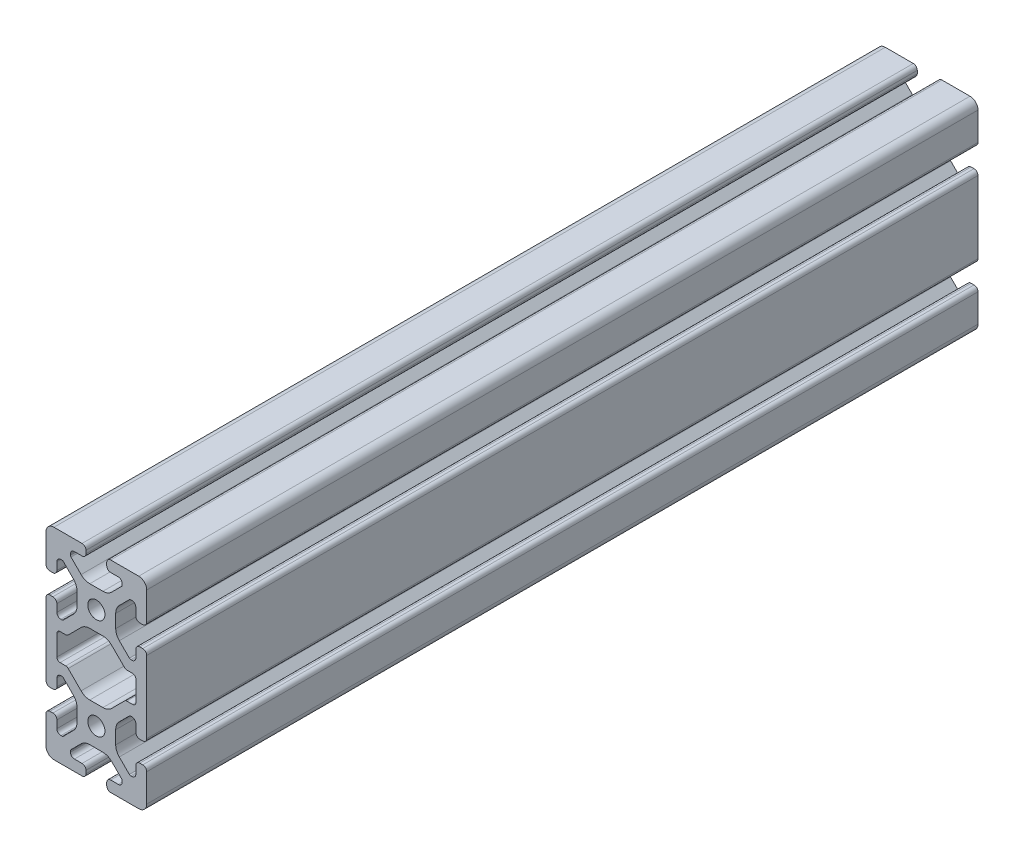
SolidWorks part; units mm, degrees
ref_plane "Front Plane" through (0, 0, 0) normal (0, 0, 1) x (1, 0, 0)
ref_plane "Top Plane" through (0, 0, 0) normal (0, 1, 0) x (1, 0, 0)
ref_plane "Right Plane" through (0, 0, 0) normal (1, 0, 0) x (0, 0, -1)
ref_plane "Plane1" through (0, 0, -3048) normal (0, 0, -1) x (-1, 0, 0)
sketch "Sketch1" plane through (0, 0, -3048) normal (0, 0, -1) x (-1, 0, 0)
  line L0 (14.41, 14.6586) -> (12.13, 14.6586)
  line L1 (11.1794, 14.2308) -> (6.0551, 9.1098)
  line L2 (2.6153, 7.685) -> (-2.6153, 7.685)
  line L3 (-6.0551, 9.1098) -> (-11.232, 14.2867)
  line L4 (-12.13, 14.6586) -> (-14.41, 14.6586)
  line L5 (-15.68, 15.9286) -> (-15.68, 24.0714)
  line L6 (-14.41, 25.3414) -> (-12.13, 25.3414)
  line L7 (-11.232, 25.7133) -> (-6.0551, 30.8902)
  line L8 (-2.6153, 32.315) -> (2.6176, 32.315)
  line L9 (6.0573, 30.8902) -> (11.1842, 25.7634)
  line L10 (12.13, 25.3414) -> (14.41, 25.3414)
  line L11 (15.68, 24.0714) -> (15.68, 15.9286)
  line L12 (16.83, 60) -> (5.6904, 60)
  line L13 (4.1204, 58.43) -> (4.1204, 57.25)
  line L14 (5.6904, 55.68) -> (8.7154, 55.68)
  line L15 (10.2854, 54.11) -> (10.2854, 53.6549)
  line L16 (10.0628, 53.1175) -> (6.0551, 49.1098)
  line L17 (2.6153, 47.685) -> (-2.6153, 47.685)
  line L18 (-6.0551, 49.1098) -> (-10.0628, 53.1175)
  line L19 (-10.2854, 53.6549) -> (-10.2854, 54.11)
  line L20 (-8.7154, 55.68) -> (-5.6904, 55.68)
  line L21 (-4.1204, 57.25) -> (-4.1204, 58.43)
  line L22 (-5.6904, 60) -> (-16.83, 60)
  line L23 (-20, 56.83) -> (-20, 45.6904)
  line L24 (-18.43, 44.1204) -> (-17.25, 44.1204)
  line L25 (-15.68, 45.6904) -> (-15.68, 48.7154)
  line L26 (-14.11, 50.2854) -> (-13.6527, 50.2854)
  line L27 (-13.1153, 50.0628) -> (-9.1098, 46.0573)
  line L28 (-7.685, 42.6176) -> (-7.685, 37.3847)
  line L29 (-9.1098, 33.9449) -> (-13.1175, 29.9372)
  line L30 (-13.6549, 29.7146) -> (-14.11, 29.7146)
  line L31 (-15.68, 31.2846) -> (-15.68, 34.3096)
  line L32 (-17.25, 35.8796) -> (-18.43, 35.8796)
  line L33 (-20, 34.3096) -> (-20, 5.6904)
  line L34 (-18.43, 4.1204) -> (-17.25, 4.1204)
  line L35 (-15.68, 5.6904) -> (-15.68, 8.7154)
  line L36 (-14.11, 10.2854) -> (-13.6549, 10.2854)
  line L37 (-13.1175, 10.0628) -> (-9.1098, 6.0551)
  line L38 (-7.685, 2.6153) -> (-7.685, -2.6153)
  line L39 (-9.1098, -6.0551) -> (-13.1175, -10.0628)
  line L40 (-13.6549, -10.2854) -> (-14.11, -10.2854)
  line L41 (-15.68, -8.7154) -> (-15.68, -5.6904)
  line L42 (-17.25, -4.1204) -> (-18.43, -4.1204)
  line L43 (-20, -5.6904) -> (-20, -16.83)
  line L44 (-16.83, -20) -> (-5.6904, -20)
  line L45 (-4.1204, -18.43) -> (-4.1204, -17.25)
  line L46 (-5.6904, -15.68) -> (-8.7154, -15.68)
  line L47 (-10.2854, -14.11) -> (-10.2854, -13.6549)
  line L48 (-10.0628, -13.1175) -> (-6.0551, -9.1098)
  line L49 (-2.6153, -7.685) -> (2.6153, -7.685)
  line L50 (6.0551, -9.1098) -> (10.0628, -13.1175)
  line L51 (10.2854, -13.6549) -> (10.2854, -14.11)
  line L52 (8.7154, -15.68) -> (5.6904, -15.68)
  line L53 (4.1204, -17.25) -> (4.1204, -18.43)
  line L54 (5.6904, -20) -> (16.83, -20)
  line L55 (20, -16.83) -> (20, -5.6904)
  line L56 (18.43, -4.1204) -> (17.25, -4.1204)
  line L57 (15.68, -5.6904) -> (15.68, -8.7154)
  line L58 (14.11, -10.2854) -> (13.6549, -10.2854)
  line L59 (13.1175, -10.0628) -> (9.1098, -6.0551)
  line L60 (7.685, -2.6153) -> (7.685, 2.6153)
  line L61 (9.1098, 6.0551) -> (13.1175, 10.0628)
  line L62 (13.6549, 10.2854) -> (14.11, 10.2854)
  line L63 (15.68, 8.7154) -> (15.68, 5.6904)
  line L64 (17.25, 4.1204) -> (18.43, 4.1204)
  line L65 (20, 5.6904) -> (20, 34.3096)
  line L66 (18.43, 35.8796) -> (17.25, 35.8796)
  line L67 (15.68, 34.3096) -> (15.68, 31.2846)
  line L68 (14.11, 29.7146) -> (13.6549, 29.7146)
  line L69 (13.1175, 29.9372) -> (9.1098, 33.9449)
  line L70 (7.685, 37.3847) -> (7.685, 42.6153)
  line L71 (9.1098, 46.0551) -> (13.1175, 50.0628)
  line L72 (13.6549, 50.2854) -> (14.11, 50.2854)
  line L73 (15.68, 48.7154) -> (15.68, 45.6904)
  line L74 (17.25, 44.1204) -> (18.43, 44.1204)
  line L75 (20, 45.6904) -> (20, 56.83)
  arc A0 (15.68, 15.9286) -> (14.41, 14.6586) centre (14.41, 15.9286) cw
  arc A1 (12.13, 14.6586) -> (11.1794, 14.2308) centre (12.13, 13.3886) ccw
  arc A2 (6.0551, 9.1098) -> (2.6153, 7.685) centre (2.6153, 12.5496) cw
  arc A3 (-2.6153, 7.685) -> (-6.0551, 9.1098) centre (-2.6153, 12.5496) cw
  arc A4 (-11.232, 14.2867) -> (-12.13, 14.6586) centre (-12.13, 13.3886) ccw
  arc A5 (-14.41, 14.6586) -> (-15.68, 15.9286) centre (-14.41, 15.9286) cw
  arc A6 (-15.68, 24.0714) -> (-14.41, 25.3414) centre (-14.41, 24.0714) cw
  arc A7 (-12.13, 25.3414) -> (-11.232, 25.7133) centre (-12.13, 26.6114) ccw
  arc A8 (-6.0551, 30.8902) -> (-2.6153, 32.315) centre (-2.6153, 27.4504) cw
  arc A9 (2.6176, 32.315) -> (6.0573, 30.8902) centre (2.6176, 27.4504) cw
  arc A10 (11.1842, 25.7634) -> (12.13, 25.3414) centre (12.13, 26.6123) ccw
  arc A11 (14.41, 25.3414) -> (15.68, 24.0714) centre (14.41, 24.0714) cw
  circle A12 centre (0, 0) radius 3.405
  circle A13 centre (0, 40) radius 3.405
  arc A14 (5.6904, 60) -> (4.1204, 58.43) centre (5.6904, 58.43) ccw
  arc A15 (4.1204, 57.25) -> (5.6904, 55.68) centre (5.6904, 57.25) ccw
  arc A16 (8.7154, 55.68) -> (10.2854, 54.11) centre (8.7154, 54.11) cw
  arc A17 (10.2854, 53.6549) -> (10.0628, 53.1175) centre (9.5254, 53.6549) cw
  arc A18 (6.0551, 49.1098) -> (2.6153, 47.685) centre (2.6153, 52.5496) cw
  arc A19 (-2.6153, 47.685) -> (-6.0551, 49.1098) centre (-2.6153, 52.5496) cw
  arc A20 (-10.0628, 53.1175) -> (-10.2854, 53.6549) centre (-9.5254, 53.6549) cw
  arc A21 (-10.2854, 54.11) -> (-8.7154, 55.68) centre (-8.7154, 54.11) cw
  arc A22 (-5.6904, 55.68) -> (-4.1204, 57.25) centre (-5.6904, 57.25) ccw
  arc A23 (-4.1204, 58.43) -> (-5.6904, 60) centre (-5.6904, 58.43) ccw
  arc A24 (-16.83, 60) -> (-20, 56.83) centre (-16.83, 56.83) ccw
  arc A25 (-20, 45.6904) -> (-18.43, 44.1204) centre (-18.43, 45.6904) ccw
  arc A26 (-17.25, 44.1204) -> (-15.68, 45.6904) centre (-17.25, 45.6904) ccw
  arc A27 (-15.68, 48.7154) -> (-14.11, 50.2854) centre (-14.11, 48.7154) cw
  arc A28 (-13.6527, 50.2854) -> (-13.1153, 50.0628) centre (-13.6527, 49.5254) cw
  arc A29 (-9.1098, 46.0573) -> (-7.685, 42.6176) centre (-12.5496, 42.6176) cw
  arc A30 (-7.685, 37.3847) -> (-9.1098, 33.9449) centre (-12.5496, 37.3847) cw
  arc A31 (-13.1175, 29.9372) -> (-13.6549, 29.7146) centre (-13.6549, 30.4746) cw
  arc A32 (-14.11, 29.7146) -> (-15.68, 31.2846) centre (-14.11, 31.2846) cw
  arc A33 (-15.68, 34.3096) -> (-17.25, 35.8796) centre (-17.25, 34.3096) ccw
  arc A34 (-18.43, 35.8796) -> (-20, 34.3096) centre (-18.43, 34.3096) ccw
  arc A35 (-20, 5.6904) -> (-18.43, 4.1204) centre (-18.43, 5.6904) ccw
  arc A36 (-17.25, 4.1204) -> (-15.68, 5.6904) centre (-17.25, 5.6904) ccw
  arc A37 (-15.68, 8.7154) -> (-14.11, 10.2854) centre (-14.11, 8.7154) cw
  arc A38 (-13.6549, 10.2854) -> (-13.1175, 10.0628) centre (-13.6549, 9.5254) cw
  arc A39 (-9.1098, 6.0551) -> (-7.685, 2.6153) centre (-12.5496, 2.6153) cw
  arc A40 (-7.685, -2.6153) -> (-9.1098, -6.0551) centre (-12.5496, -2.6153) cw
  arc A41 (-13.1175, -10.0628) -> (-13.6549, -10.2854) centre (-13.6549, -9.5254) cw
  arc A42 (-14.11, -10.2854) -> (-15.68, -8.7154) centre (-14.11, -8.7154) cw
  arc A43 (-15.68, -5.6904) -> (-17.25, -4.1204) centre (-17.25, -5.6904) ccw
  arc A44 (-18.43, -4.1204) -> (-20, -5.6904) centre (-18.43, -5.6904) ccw
  arc A45 (-20, -16.83) -> (-16.83, -20) centre (-16.83, -16.83) ccw
  arc A46 (-5.6904, -20) -> (-4.1204, -18.43) centre (-5.6904, -18.43) ccw
  arc A47 (-4.1204, -17.25) -> (-5.6904, -15.68) centre (-5.6904, -17.25) ccw
  arc A48 (-8.7154, -15.68) -> (-10.2854, -14.11) centre (-8.7154, -14.11) cw
  arc A49 (-10.2854, -13.6549) -> (-10.0628, -13.1175) centre (-9.5254, -13.6549) cw
  arc A50 (-6.0551, -9.1098) -> (-2.6153, -7.685) centre (-2.6153, -12.5496) cw
  arc A51 (2.6153, -7.685) -> (6.0551, -9.1098) centre (2.6153, -12.5496) cw
  arc A52 (10.0628, -13.1175) -> (10.2854, -13.6549) centre (9.5254, -13.6549) cw
  arc A53 (10.2854, -14.11) -> (8.7154, -15.68) centre (8.7154, -14.11) cw
  arc A54 (5.6904, -15.68) -> (4.1204, -17.25) centre (5.6904, -17.25) ccw
  arc A55 (4.1204, -18.43) -> (5.6904, -20) centre (5.6904, -18.43) ccw
  arc A56 (16.83, -20) -> (20, -16.83) centre (16.83, -16.83) ccw
  arc A57 (20, -5.6904) -> (18.43, -4.1204) centre (18.43, -5.6904) ccw
  arc A58 (17.25, -4.1204) -> (15.68, -5.6904) centre (17.25, -5.6904) ccw
  arc A59 (15.68, -8.7154) -> (14.11, -10.2854) centre (14.11, -8.7154) cw
  arc A60 (13.6549, -10.2854) -> (13.1175, -10.0628) centre (13.6549, -9.5254) cw
  arc A61 (9.1098, -6.0551) -> (7.685, -2.6153) centre (12.5496, -2.6153) cw
  arc A62 (7.685, 2.6153) -> (9.1098, 6.0551) centre (12.5496, 2.6153) cw
  arc A63 (13.1175, 10.0628) -> (13.6549, 10.2854) centre (13.6549, 9.5254) cw
  arc A64 (14.11, 10.2854) -> (15.68, 8.7154) centre (14.11, 8.7154) cw
  arc A65 (15.68, 5.6904) -> (17.25, 4.1204) centre (17.25, 5.6904) ccw
  arc A66 (18.43, 4.1204) -> (20, 5.6904) centre (18.43, 5.6904) ccw
  arc A67 (20, 34.3096) -> (18.43, 35.8796) centre (18.43, 34.3096) ccw
  arc A68 (17.25, 35.8796) -> (15.68, 34.3096) centre (17.25, 34.3096) ccw
  arc A69 (15.68, 31.2846) -> (14.11, 29.7146) centre (14.11, 31.2846) cw
  arc A70 (13.6549, 29.7146) -> (13.1175, 29.9372) centre (13.6549, 30.4746) cw
  arc A71 (9.1098, 33.9449) -> (7.685, 37.3847) centre (12.5496, 37.3847) cw
  arc A72 (7.685, 42.6153) -> (9.1098, 46.0551) centre (12.5496, 42.6153) cw
  arc A73 (13.1175, 50.0628) -> (13.6549, 50.2854) centre (13.6549, 49.5254) cw
  arc A74 (14.11, 50.2854) -> (15.68, 48.7154) centre (14.11, 48.7154) cw
  arc A75 (15.68, 45.6904) -> (17.25, 44.1204) centre (17.25, 45.6904) ccw
  arc A76 (18.43, 44.1204) -> (20, 45.6904) centre (18.43, 45.6904) ccw
  arc A77 (20, 56.83) -> (16.83, 60) centre (16.83, 56.83) ccw
extrude "Boss-Extrude1" add sketch "Sketch1" against normal blind 3048
ref_plane "2.5 ft cut1" through (0, 0, -762) normal (0, 0, 1) x (1, 0, 0)
ref_plane "2.5 ft cut2" through (0, 0, -1524) normal (0, 0, 1) x (1, 0, 0)
ref_plane "16.14 in cut3" through (0, 0, -1933.956) normal (0, 0, 1) x (1, 0, 0)
ref_plane "13 in cut4" through (0, 0, -2264.156) normal (0, 0, 1) x (1, 0, 0)
ref_plane "midplane cut5" through (0, 0, -2656.078) normal (0, 0, 1) x (1, 0, 0)
sketch "Sketch26" plane through (0, 0, -762) normal (0, 0, 1) x (1, 0, 0)
  line L0 (-20, -20.8001) -> (20, -20.8001)
  line L1 (-20, -20.8001) -> (-20, 60)
  line L2 (-20, 60) -> (20, 60)
  line L3 (20, -20.8001) -> (20, 60)
sketch "Sketch33" plane through (0, 0, -1524) normal (0, 0, 1) x (1, 0, 0)
  line L5 (-20, 60) -> (20, 60)
  line L6 (-20, 60) -> (-20, -20.8001)
  line L7 (-20, -20.8001) -> (20, -20.8001)
  line L8 (20, 60) -> (20, -20.8001)
sketch "Sketch41" plane through (0, 0, -1933.956) normal (0, 0, 1) x (1, 0, 0)
  line L0 (-20, -20.8001) -> (20, -20.8001)
  line L1 (-20, -20.8001) -> (-20, 60)
  line L2 (-20, 60) -> (20, 60)
  line L3 (20, -20.8001) -> (20, 60)
sketch "Sketch50" plane through (0, 0, -2264.156) normal (0, 0, 1) x (1, 0, 0)
  line L0 (-20, -20.8001) -> (20, -20.8001)
  line L1 (-20, -20.8001) -> (-20, 60)
  line L2 (-20, 60) -> (20, 60)
  line L3 (20, -20.8001) -> (20, 60)
sketch "Sketch51" plane through (0, 0, -2656.078) normal (0, 0, 1) x (1, 0, 0)
  line L1 (-20, 60) -> (20, 60)
  line L2 (-20, 60) -> (-20, -20.8001)
  line L3 (-20, -20.8001) -> (20, -20.8001)
  line L4 (20, 60) -> (20, -20.8001)
extrude "Cut-Extrude1" cut sketch "Sketch26" along normal through all
extrude "Cut-Extrude2" cut sketch "Sketch33" along normal through all
extrude "Cut-Extrude3" cut sketch "Sketch41" along normal through all
extrude "Cut-Extrude4" cut sketch "Sketch50" against normal through all
sketch "Sketch52" plane through (-20, 0, 0) normal (-1, 0, 0) x (0, 0, 1)
  circle A0 centre (-1972.456, 38.65) radius 2.5
  circle A1 centre (-2009.756, 38.65) radius 2.5
  circle A2 centre (-2009.756, 1.35) radius 2.5
  circle A3 centre (-1972.456, 1.35) radius 2.5
  circle A4 centre (-2188.112, 1.35) radius 2.5
  circle A5 centre (-2225.412, 1.35) radius 2.5
  circle A6 centre (-2225.412, 38.65) radius 2.5
  circle A7 centre (-2188.112, 38.65) radius 2.5
extrude "Cut-Extrude5" cut sketch "Sketch52" against normal through all
